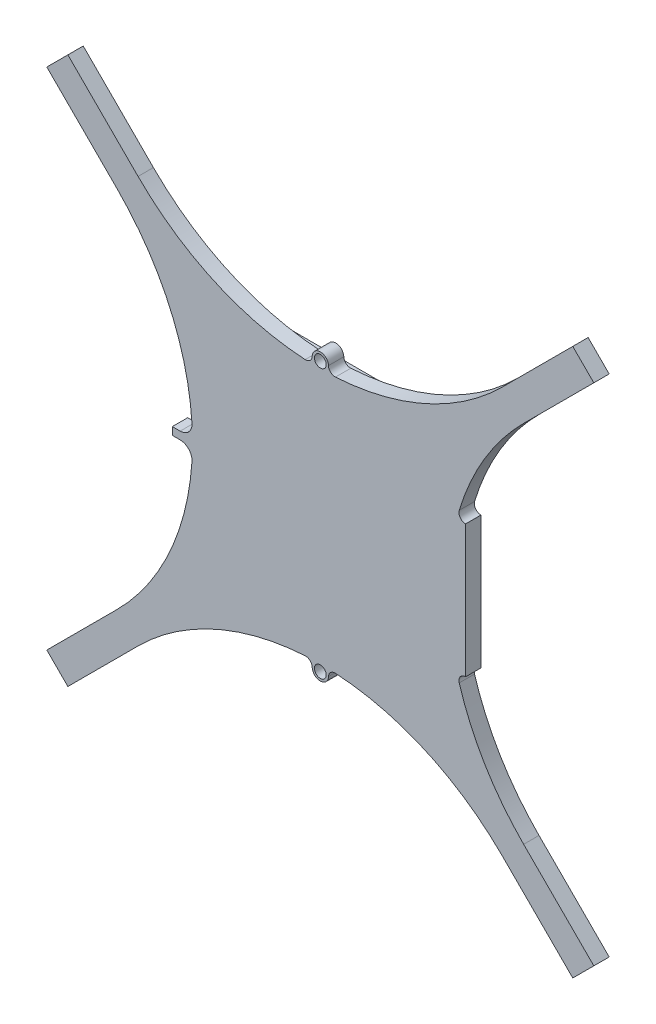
SolidWorks part; units mm, degrees
ref_plane "Front Plane" through (0, 0, 0) normal (0, 0, 1) x (1, 0, 0)
ref_plane "Top Plane" through (0, 0, 0) normal (0, 1, 0) x (1, 0, 0)
ref_plane "Right Plane" through (0, 0, 0) normal (1, 0, 0) x (0, 0, -1)
other "Center of Mass"
sketch "Sketch1" plane through (0, 0, 0) normal (0, 0, 1) x (1, 0, 0)
  line L0 (-27.1352, 29.398) -> (-29.398, 27.1352)
  line L1 (-21.8551, 19.5923) -> (-29.398, 27.1352)
  line L2 (-21.8551, -19.5923) -> (-29.398, -27.1352)
  line L3 (29.398, 27.1352) -> (27.1352, 29.398)
  line L4 (0, 0) -> (0, -41.4474) construction
  line L5 (19.5923, 21.8551) -> (27.1352, 29.398)
  line L6 (-19.5923, 21.8551) -> (-27.1352, 29.398)
  line L7 (27.1352, -29.398) -> (29.398, -27.1352)
  line L8 (21.8551, -19.5923) -> (29.398, -27.1352)
  line L9 (21.8551, 19.5923) -> (29.398, 27.1352)
  line L10 (19.5923, -21.8551) -> (27.1352, -29.398)
  line L11 (0, 0) -> (0, 41.4474) construction
  line L12 (-29.398, -27.1352) -> (-27.1352, -29.398)
  line L13 (0, 0) -> (-15.9085, 0) construction
  line L14 (15.6189, 7.115) -> (15.6189, -7.115)
  line L15 (0, 0) -> (33.3791, 33.3791) construction
  line L16 (15.6189, 7.115) -> (14.6688, 7.115)
  line L17 (-19.5923, -21.8551) -> (-27.1352, -29.398)
  line L18 (15.6189, -7.115) -> (14.6688, -7.115)
  line L19 (-15.9085, -0.4114) -> (-13.7427, -0.4114)
  line L20 (-15.9085, -0.4114) -> (-15.9085, 0.4114)
  line L21 (-15.9085, 0.4114) -> (-13.7427, 0.4114)
  arc A0 (19.5923, -21.8551) -> (0.5189, -13.7445) centre (0, -41.4474) ccw
  arc A1 (-21.8551, -19.5923) -> (-13.7427, -0.4114) centre (-41.4474, 0) ccw
  arc A2 (-19.5923, 21.8551) -> (-0.5189, 13.7445) centre (0, 41.4474) ccw
  arc A3 (21.8551, 19.5923) -> (14.6688, 7.115) centre (41.4474, 0) ccw
  arc A4 (0.5189, 13.7445) -> (-0.5189, 13.7445) centre (0, 14.4491) ccw
  circle A5 centre (0, 14.4491) radius 0.6348
  arc A6 (0.5189, 13.7445) -> (19.5923, 21.8551) centre (0, 41.4474) ccw
  circle A7 centre (0, -14.4491) radius 0.6348
  arc A8 (0.5189, -13.7445) -> (-0.5189, -13.7445) centre (0, -14.4491) cw
  arc A9 (-0.5189, -13.7445) -> (-19.5923, -21.8551) centre (0, -41.4474) ccw
  arc A10 (14.6688, -7.115) -> (21.8551, -19.5923) centre (41.4474, 0) ccw
  arc A11 (-13.7427, 0.4114) -> (-21.8551, 19.5923) centre (-41.4474, 0) ccw
  point P17 (0, 0)
  point P32 (0, 0)
  point P33 (0, 0)
  point P39 (15.6189, 0)
  dimension "D2" = 27.7077
  dimension "D10" = 1.75
  dimension "D11" = 14.4491
  dimension "D12" = 0.2402
  dimension "D1" = 41.4474
  dimension "D3" = 4
  dimension "D4" = 135
  dimension "D5" = 4
  dimension "D6" = 10.6673
  dimension "D7" = 3.2
  dimension "D8" = 39.975
  dimension "D13" = 15.6189
  dimension "D14" = 7.115
  dimension "D15" = 0.4114
  dimension "D16" = 2.1658
  dimension "D9" = 4
extrude "Boss-Extrude1" add sketch "Sketch1" along normal blind 1.65
fillet "Fillet1" radius 0.7112 4 edges at (-0.5189, -13.7445, 0.825) (0.5189, -13.7445, 0.825) (-0.5189, 13.7445, 0.825) (0.5189, 13.7445, 0.825)
fillet "Fillet2" radius 0.7112 2 edges at (14.6688, -7.115, 0.825) (14.6688, 7.115, 0.825)
fillet "Fillet3" radius 1.27 2 edges at (-13.7427, 0.4114, 0.825) (-13.7427, -0.4114, 0.825)
sketch "Sketch2" plane through (0, 0, 0) normal (0, 0, -1) x (-1, 0, 0)
  line L0 (0, 14.4491) -> (0, -14.4491) construction
  line L1 (15.9085, 0) -> (-15.6189, 0) construction
  line L2 (11.5, 9.228) -> (-11.5, 9.228)
  line L3 (11.5, 9.228) -> (11.5, -9.228) construction
  line L4 (11.5, -9.228) -> (-11.5, -9.228)
  line L5 (-11.5, 9.228) -> (-11.5, -9.228) construction
  line L6 (15.9085, 0.4114) -> (15.9085, -0.4114) construction
  line L7 (-15.6189, -7.115) -> (-15.6189, 7.115) construction
  line L8 (11.5, -9.228) -> (11.5, -11.542)
  line L9 (11.5, -11.542) -> (-11.5, -11.542)
  line L10 (-11.5, -11.542) -> (-11.5, -9.228)
  line L11 (-11.5, 11.542) -> (-11.5, 9.228)
  line L12 (11.5, 11.542) -> (-11.5, 11.542)
  line L13 (11.5, 9.228) -> (11.5, 11.542)
  line L14 (11.5, -10.385) -> (-11.5, -10.385) construction
  circle A0 centre (8, -10.385) radius 0.33
  circle A1 centre (6.222, -10.385) radius 0.33
  circle A2 centre (4.444, -10.385) radius 0.33
  circle A3 centre (2.666, -10.385) radius 0.33
  circle A4 centre (0.888, -10.385) radius 0.33
  circle A5 centre (-0.89, -10.385) radius 0.33
  circle A6 centre (-2.668, -10.385) radius 0.33
  circle A7 centre (-4.446, -10.385) radius 0.33
  circle A8 centre (-6.224, -10.385) radius 0.33
  circle A9 centre (-8.002, -10.385) radius 0.33
  circle A10 centre (-8.002, 10.385) radius 0.33
  circle A11 centre (-6.224, 10.385) radius 0.33
  circle A12 centre (-4.446, 10.385) radius 0.33
  circle A13 centre (-2.668, 10.385) radius 0.33
  circle A14 centre (-0.89, 10.385) radius 0.33
  circle A15 centre (0.888, 10.385) radius 0.33
  circle A16 centre (2.666, 10.385) radius 0.33
  circle A17 centre (4.444, 10.385) radius 0.33
  circle A18 centre (6.222, 10.385) radius 0.33
  circle A19 centre (8, 10.385) radius 0.33
  point P8 (0, 9.228)
  point P15 (11.5, 0)
  dimension "D4" = 0.66
  dimension "D1" = 18.456
  dimension "D2" = 23
  dimension "D3" = 2.314
  dimension "D5" = 3.5
  dimension "D6" = 10
extrude "Boss-Extrude2" add sketch "Sketch2" along normal blind 2.6
